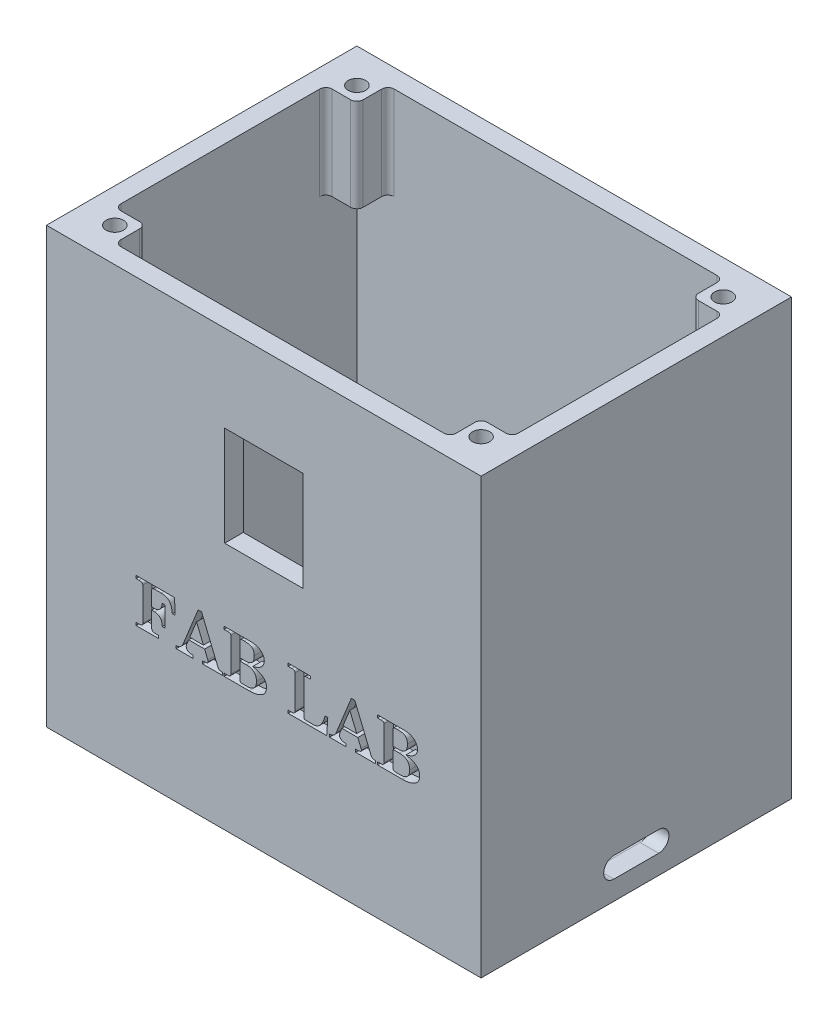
SolidWorks part; units mm, degrees
ref_plane "Front Plane" through (0, 0, 0) normal (0, 0, 1) x (1, 0, 0)
ref_plane "Top Plane" through (0, 0, 0) normal (0, 1, 0) x (1, 0, 0)
ref_plane "Right Plane" through (0, 0, 0) normal (1, 0, 0) x (0, 0, -1)
sketch "Sketch1" plane through (0, 0, 0) normal (0, 1, 0) x (1, 0, 0)
  line L1 (-35, 25) -> (35, 25)
  line L2 (-35, 25) -> (-35, -25)
  line L3 (-35, -25) -> (35, -25)
  line L4 (35, 25) -> (35, -25)
  line L5 (-35, 25) -> (35, -25) construction
  line L6 (-35, -25) -> (35, 25) construction
  point P4 (0, 0)
  point P5 (0, 0)
  dimension "D1" = 50
  dimension "D2" = 70
extrude "Boss-Extrude1" add sketch "Sketch1" along normal blind 70
sketch "Sketch2" plane through (0, 70, 0) normal (0, 1, 0) x (1, 0, 0)
  line L8 (-32, 22) -> (-32, -22)
  line L9 (-32, -22) -> (32, -22)
  line L10 (32, -22) -> (32, 22)
  line L11 (32, 22) -> (-32, 22)
  line L12 (-32, 22) -> (-32, -22)
  line L13 (-32, -22) -> (32, -22)
  line L14 (32, -22) -> (32, 22)
  line L15 (32, 22) -> (-32, 22)
  dimension "D1" = 3
extrude "Cut-Extrude1" cut sketch "Sketch2" against normal blind 67
sketch "Sketch3" plane through (0, 0, 25) normal (0, 0, 1) x (1, 0, 0)
  line L1 (-6.3, 56.05) -> (6.3, 56.05)
  line L2 (-6.3, 56.05) -> (-6.3, 40)
  line L3 (-6.3, 40) -> (6.3, 40)
  line L4 (6.3, 56.05) -> (6.3, 40)
  line L5 (-6.3, 56.05) -> (6.3, 40) construction
  line L6 (-6.3, 40) -> (6.3, 56.05) construction
  point P4 (0, 48.025)
  point P5 (0, 0)
  point P8 (0, 0)
  dimension "D1" = 16.05
  dimension "D2" = 12.6
  dimension "D3" = 40
extrude "Cut-Extrude2" cut sketch "Sketch3" against normal blind 5
sketch "Sketch4" plane through (0, 0, -25) normal (0, 0, -1) x (-1, 0, 0)
  line L0 (-35, 0) -> (35, 0) construction
  line L1 (18, 22.5) -> (30, 22.5)
  line L2 (18, 22.5) -> (18, 5)
  line L3 (18, 5) -> (30, 5)
  line L4 (30, 22.5) -> (30, 5)
  line L5 (18, 22.5) -> (30, 5) construction
  line L6 (18, 5) -> (30, 22.5) construction
  line L7 (35, 70) -> (35, 0) construction
  circle A0 centre (5, 8) radius 3
  point P4 (24, 13.75)
  dimension "D5" = 6
  dimension "D1" = 12
  dimension "D2" = 17.5
  dimension "D3" = 5
  dimension "D4" = 5
  dimension "D6" = 8
  dimension "D7" = 5
extrude "Cut-Extrude3" cut sketch "Sketch4" against normal blind 5
sketch "Sketch5" plane through (35, 0, 0) normal (1, 0, 0) x (0, 0, -1)
  line L0 (-3.6, 4.75) -> (3.6, 4.75) construction
  line L1 (-3.6, 6.4) -> (3.6, 6.4)
  line L2 (-3.6, 3.1) -> (3.6, 3.1)
  arc A0 (-3.6, 6.4) -> (-3.6, 3.1) centre (-3.6, 4.75) ccw
  arc A1 (3.6, 3.1) -> (3.6, 6.4) centre (3.6, 4.75) ccw
  point P2 (0, 4.75)
  point P7 (0, 0)
  dimension "D1" = 7.2
  dimension "D2" = 3.3
  dimension "D3" = 3.1
extrude "Cut-Extrude4" cut sketch "Sketch5" against normal blind 5
sketch "Sketch6" plane through (0, 70, 0) normal (0, 1, 0) x (1, 0, 0)
  line L0 (-32, -17) -> (-27, -17)
  line L1 (-27, -22) -> (-27, -17)
  line L2 (-32, -22) -> (-27, -22)
  line L3 (-32, -22) -> (-32, -17)
  line L4 (0, -22) -> (0, 22) construction
  line L5 (-32, 22) -> (-27, 22)
  line L6 (-32, 22) -> (-32, 17)
  line L7 (-32, 17) -> (-27, 17)
  line L8 (32, 22) -> (-32, 22)
  line L9 (-32, 22) -> (-32, -22)
  line L10 (-32, -22) -> (32, -22)
  line L11 (32, -22) -> (32, 22)
  line L12 (32, 22) -> (-32, 22) construction
  line L13 (-32, 22) -> (-32, -22) construction
  line L14 (-32, -22) -> (32, -22) construction
  line L15 (32, -22) -> (32, 22) construction
  line L16 (-27, 22) -> (-27, 17)
  line L17 (-32, 22) -> (-27, 17) construction
  line L18 (-32, 17) -> (-27, 22) construction
  line L19 (32, 0) -> (-32, 0) construction
  line L20 (32, 17) -> (27, 17)
  line L21 (27, 22) -> (27, 17)
  line L22 (32, 22) -> (27, 22)
  line L23 (32, 22) -> (32, 17)
  line L24 (32, -22) -> (32, -17)
  line L25 (32, -22) -> (27, -22)
  line L26 (27, -22) -> (27, -17)
  line L27 (32, -17) -> (27, -17)
  circle A0 centre (-29.5, 19.5) radius 1.4
  circle A1 centre (29.5, 19.5) radius 1.4
  circle A2 centre (-29.5, -19.5) radius 1.4
  circle A3 centre (29.5, -19.5) radius 1.4
  point P5 (-29.5, 19.5)
  dimension "D4" = 2.8
  dimension "D2" = 5
  dimension "D3" = 5
  dimension "D1" = 0
extrude "Boss-Extrude2" add sketch "Sketch6" against normal blind 15
fillet "Fillet1" radius 1 12 edges at (32, 62.5, -17) (27, 62.5, -17) (27, 62.5, -22) (-27, 62.5, -22) (-27, 62.5, -17) (-32, 62.5, -17) (-32, 62.5, 17) (-27, 62.5, 17) (27, 62.5, 22) (27, 62.5, 17) (32, 62.5, 17) (-27, 62.5, 22)
sketch "Sketch7" plane through (0, 0, 25) normal (0, 0, 1) x (1, 0, 0)
  line L0 (-21.0113, 21.3794) -> (21.0113, 21.3794) construction
  text T0 "<b>FAB LAB</b>" font "Century Schoolbook" height 7
  point P2 (0, 21.3794)
extrude "Cut-Extrude5" cut sketch "Sketch7" against normal blind 1.5
